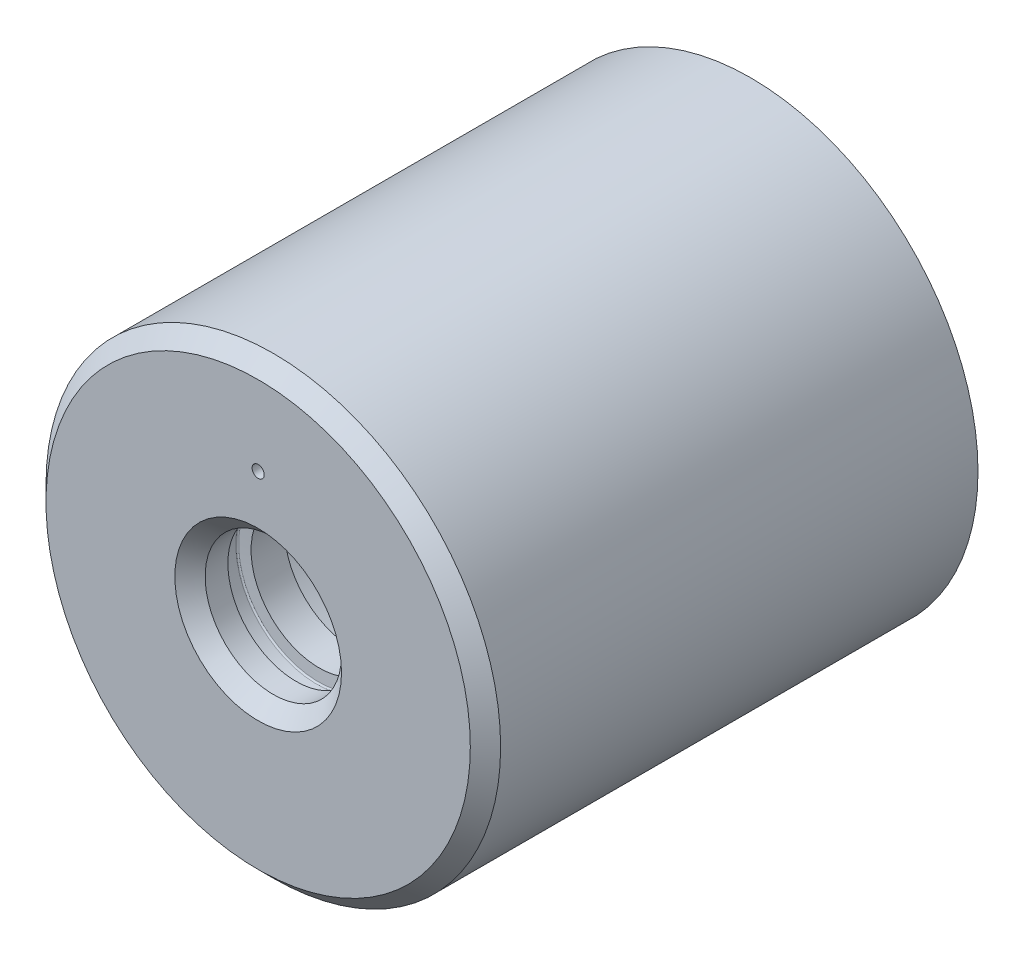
SolidWorks part; units mm, degrees
ref_plane "Front Plane" through (0, 0, 0) normal (0, 0, 1) x (1, 0, 0)
ref_plane "Top Plane" through (0, 0, 0) normal (0, 1, 0) x (1, 0, 0)
ref_plane "Right Plane" through (0, 0, 0) normal (1, 0, 0) x (0, 0, -1)
sketch "Sketch1" plane through (0, 0, 0) normal (0, 0, 1) x (1, 0, 0)
  circle A0 centre (0, 0) radius 38.1 construction
  circle A1 centre (0, 0) radius 38.1
  circle A2 centre (0, 0) radius 26.67
  dimension "D1" = 53.34
extrude "tube" add sketch "Sketch1" along normal blind 66.675
sketch "Sketch2" plane through (0, 0, 66.675) normal (0, 0, 1) x (1, 0, 0)
  circle A0 centre (0, 0) radius 38.1 construction
  circle A1 centre (0, 0) radius 38.1
  circle A2 centre (0, 0) radius 11.43
  dimension "D1" = 22.86
extrude "end" add sketch "Sketch2" along normal blind 15.875
chamfer "Chamfer1" distance 2.54 angle 45 2 edges at (38.1, 0, 82.55) (11.43, 0, 82.55)
sketch "Sketch3" plane through (0, 0, 82.55) normal (0, 0, 1) x (1, 0, 0)
  line L0 (0, 0) -> (0, 41.4975) construction
  circle A0 centre (0, 22.225) radius 1.016
  dimension "D1" = 2.032
  dimension "D2" = 22.225
extrude "vent" cut sketch "Sketch3" against normal through all
ref_plane "Plane1" through (0, 0, 82.55) normal (-1, 0, 0) x (0, 1, 0)
sketch "Sketch5" plane through (0, 0, 82.55) normal (-1, 0, 0) x (0, 1, 0)
  line L0 (13.3444, 10.0735) -> (11.43, 10.241)
  line L1 (11.43, 10.241) -> (11.43, 6.35)
  line L2 (11.43, 6.35) -> (13.3444, 6.5175)
  line L3 (13.5763, 6.7705) -> (13.5763, 9.8205)
  line L4 (0, 50) -> (0, -50) construction
  line L5 (11.43, 2.54) -> (11.43, 15.875) construction
  line L6 (-35.56, 0) -> (35.56, 0) construction
  arc A0 (13.3444, 6.5175) -> (13.5763, 6.7705) centre (13.3223, 6.7705) ccw
  arc A1 (13.5763, 9.8205) -> (13.3444, 10.0735) centre (13.3223, 9.8205) ccw
  dimension "D1" = 3.891
  dimension "D2" = 2.1463
  dimension "D3" = 95
  dimension "D4" = 95
  dimension "D5" = 6.35
revolve "Groove for AS 568-118, O-Ring1" cut sketch "Sketch5"
